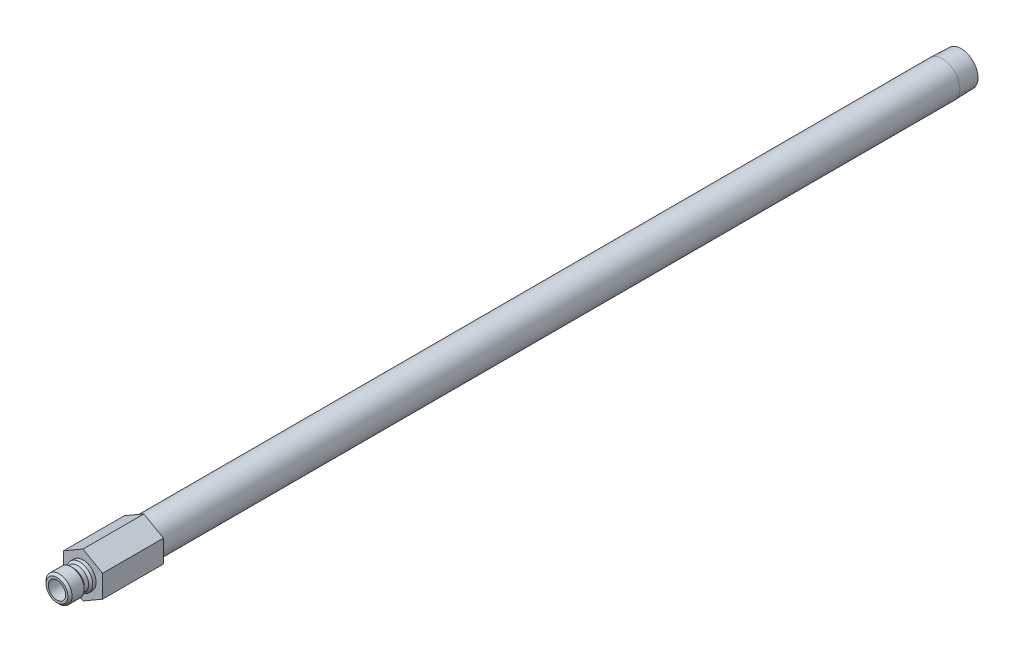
SolidWorks part; units mm, degrees
ref_plane "Front Plane" through (0, 0, 0) normal (0, 0, 1) x (1, 0, 0)
ref_plane "Top Plane" through (0, 0, 0) normal (0, 1, 0) x (1, 0, 0)
ref_plane "Right Plane" through (0, 0, 0) normal (1, 0, 0) x (0, 0, -1)
sketch "Sketch1" plane through (0, 0, 0) normal (1, 0, 0) x (0, 0, -1)
  line L0 (0, 0) -> (-12.7, 0) construction
  line L1 (-9.525, 3.175) -> (-9.525, 4.0005)
  line L2 (-3.556, 4.0005) -> (-3.556, 0) construction
  line L3 (-8.763, 4.7625) -> (-4.318, 4.7625)
  line L4 (0, 6.35) -> (0, 0) construction
  line L5 (-3.556, 4.0005) -> (-1.9685, 4.0005)
  line L6 (-1.2065, 4.7625) -> (0, 4.7625)
  line L7 (0, 4.7625) -> (0, 6.35)
  line L8 (-3.556, 4.0005) -> (-4.318, 4.7625)
  line L9 (-1.9685, 4.0005) -> (-1.2065, 4.7625)
  line L10 (-9.525, 4.0005) -> (-8.763, 4.7625)
  line L11 (22.225, 4.6228) -> (320.675, 4.6228)
  line L12 (0, 6.35) -> (313.817, 6.35)
  line L13 (313.817, 6.35) -> (320.675, 6.1357)
  line L14 (320.675, 6.1357) -> (320.675, 4.6228)
  line L15 (0, 0) -> (22.225, 0) construction
  line L16 (22.225, 0) -> (22.225, 4.7625) construction
  line L17 (22.225, 4.7625) -> (0, 4.7625) construction
  line L18 (22.225, 4.6228) -> (22.225, 3.175)
  line L19 (22.225, 3.175) -> (-9.525, 3.175)
  dimension "D1" = 9.525
  dimension "D2" = 1.5875
  dimension "D3" = 0.762
  dimension "D4" = 45
  dimension "D5" = 5.969
  dimension "D6" = 45
  dimension "D7" = 1.79
  dimension "D8" = 6.858
  dimension "D9" = 330.2
  dimension "D10" = 3.175
  dimension "D11" = 31.75
  dimension "D12" = 9.2456
  dimension "D13" = 6.35
  dimension "D14" = 9.525
  dimension "D15" = 12.7
revolve "Revolve1" add sketch "Sketch1" angle 360 about L0
sketch "Sketch2" plane through (0, 0, 0) normal (0, 0, 1) x (1, 0, 0)
  line L1 (-7.112, 4.1061) -> (-7.112, -4.1061)
  line L2 (-7.112, -4.1061) -> (0, -8.2122)
  line L3 (0, -8.2122) -> (7.112, -4.1061)
  line L4 (7.112, -4.1061) -> (7.112, 4.1061)
  line L5 (7.112, 4.1061) -> (0, 8.2122)
  line L6 (0, 8.2122) -> (-7.112, 4.1061)
  circle A0 centre (0, 0) radius 7.112 construction
  circle A1 centre (0, 0) radius 3.175 construction
  circle A2 centre (0, 0) radius 3.175
  dimension "D1" = 14.224
extrude "Boss-Extrude1" add sketch "Sketch2" against normal up to vertex (22.225 mm away) from vertex at 0
